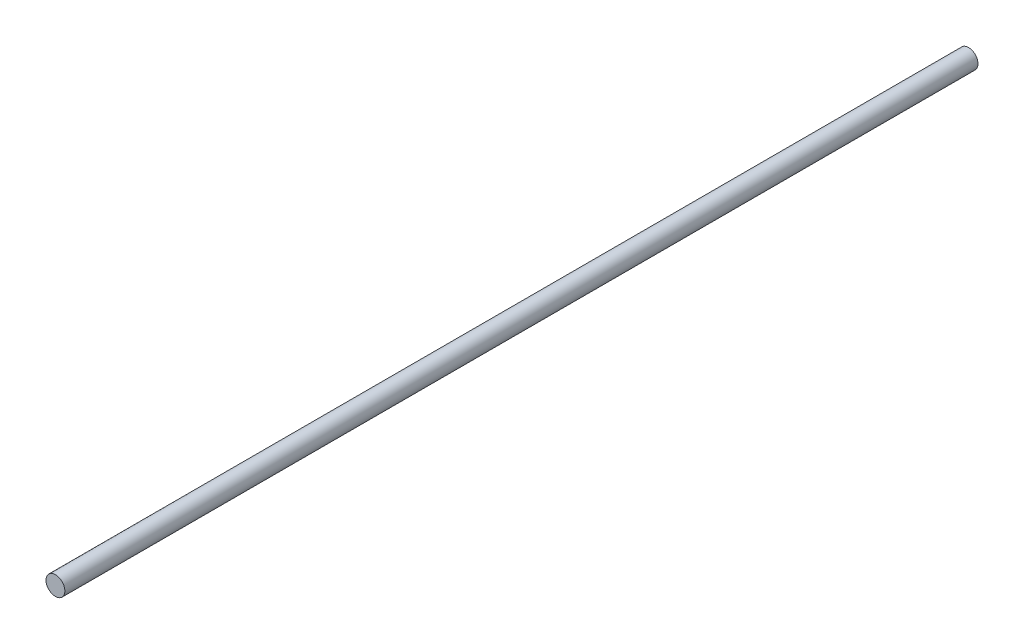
SolidWorks part; units mm, degrees
ref_plane "Front Plane" through (0, 0, 0) normal (0, 0, 1) x (1, 0, 0)
ref_plane "Top Plane" through (0, 0, 0) normal (0, 1, 0) x (1, 0, 0)
ref_plane "Right Plane" through (0, 0, 0) normal (1, 0, 0) x (0, 0, -1)
sketch "Sketch1" plane through (0, 0, 0) normal (0, 0, 1) x (1, 0, 0)
  circle A0 centre (0, 0) radius 30
  dimension "D1" = 60
extrude "Boss-Extrude1" add sketch "Sketch1" against normal blind 2900
